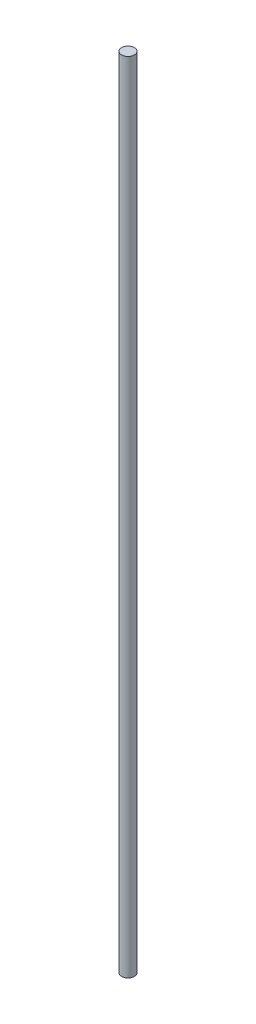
SolidWorks part; units mm, degrees
ref_plane "Спереди" through (0, 0, 0) normal (0, 0, 1) x (1, 0, 0)
ref_plane "Сверху" through (0, 0, 0) normal (0, 1, 0) x (1, 0, 0)
ref_plane "Справа" through (0, 0, 0) normal (1, 0, 0) x (0, 0, -1)
sketch "Эскиз1" plane through (0, 0, 0) normal (0, 1, 0) x (1, 0, 0)
  circle A0 centre (0, 0) radius 8
  dimension "D1" = 16
extrude "Бобышка-Вытянуть1" add sketch "Эскиз1" along normal blind 1000
